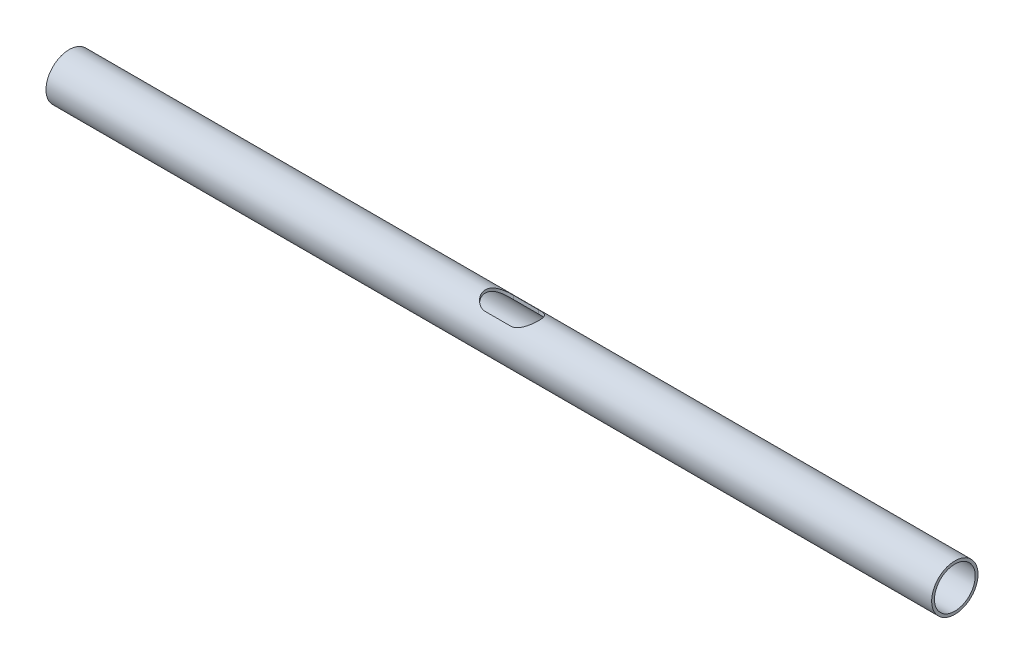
SolidWorks part; units mm, degrees
ref_plane "Plan de face" through (0, 0, 0) normal (0, 0, 1) x (1, 0, 0)
ref_plane "Plan de dessus" through (0, 0, 0) normal (0, 1, 0) x (1, 0, 0)
ref_plane "Plan de droite" through (0, 0, 0) normal (1, 0, 0) x (0, 0, -1)
sketch "Esquisse1" plane through (0, 0, 0) normal (0, 0, 1) x (1, 0, 0)
  line L0 (-68.8177, 0) -> (71.7208, 0) construction
  line L1 (0, 14.5) -> (0, 0) construction
  line L2 (-315, 16.5) -> (315, 16.5)
  line L3 (-315, 16.5) -> (-315, 14.5)
  line L4 (-315, 14.5) -> (315, 14.5)
  line L5 (315, 16.5) -> (315, 14.5)
  dimension "D1" = 33
  dimension "D2" = 2
  dimension "D3" = 630
revolve "Révolution1" add sketch "Esquisse1" angle 360 about L0
sketch "Esquisse2" plane through (0, 0, 0) normal (0, 1, 0) x (1, 0, 0)
  line L0 (9, 0) -> (-9, 0) construction
  line L1 (9, -10) -> (-9, -10)
  line L2 (9, 10) -> (-9, 10)
  arc A0 (9, -10) -> (9, 10) centre (9, 0) ccw
  arc A1 (-9, 10) -> (-9, -10) centre (-9, 0) ccw
  point P2 (0, 0)
  point P7 (0, 0)
  dimension "D1" = 20
  dimension "D2" = 18
extrude "Enlèv. mat.-Extru.1" cut sketch "Esquisse2" along normal blind 36 contours A1 L1 A0 L2
